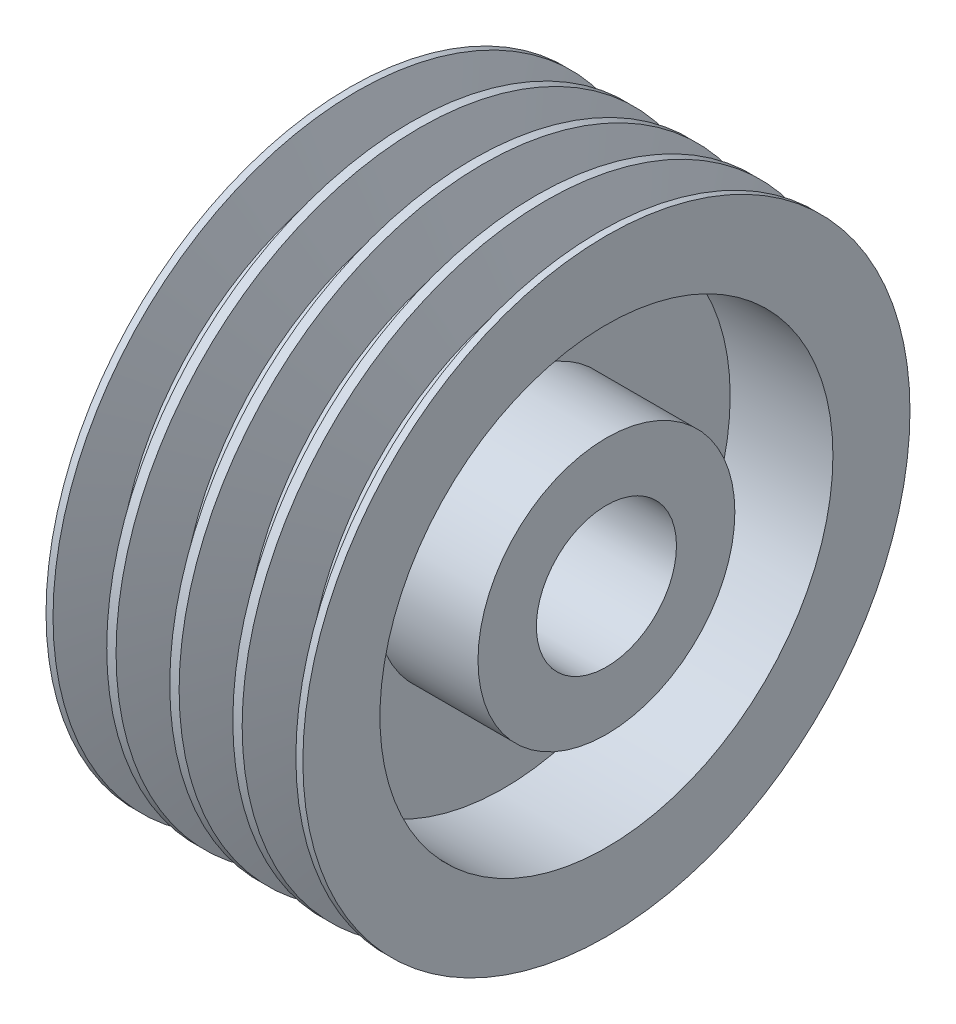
SolidWorks part; units mm, degrees
ref_plane "Front Plane" through (0, 0, 0) normal (0, 0, 1) x (1, 0, 0)
ref_plane "Top Plane" through (0, 0, 0) normal (0, 1, 0) x (1, 0, 0)
ref_plane "Right Plane" through (0, 0, 0) normal (1, 0, 0) x (0, 0, -1)
sketch "Sketch1" plane through (0, 0, 0) normal (0, 0, 1) x (1, 0, 0)
  line L0 (-55, 97) -> (-11, 97)
  line L1 (-55, 30) -> (55, 30)
  line L2 (-55, 30) -> (-55, 55)
  line L3 (-55, 130) -> (-52, 130)
  line L4 (55, 30) -> (55, 55)
  line L5 (-11, 97) -> (-11, 55)
  line L6 (-11, 55) -> (-55, 55)
  line L7 (67.6211, 0) -> (-42.3789, 0) construction
  line L8 (0, 130) -> (0, 0) construction
  line L9 (55, 97) -> (11, 97)
  line L10 (11, 97) -> (11, 55)
  line L11 (11, 55) -> (55, 55)
  line L12 (55, 97) -> (55, 130)
  line L13 (-55, 97) -> (-55, 130)
  line L14 (-52, 130) -> (-45.5, 109)
  line L15 (-45.5, 109) -> (-35.5, 109)
  line L16 (-35.5, 109) -> (-29, 130)
  line L17 (-25, 130) -> (-18.5, 109)
  line L18 (-18.5, 109) -> (-8.5, 109)
  line L19 (-8.5, 109) -> (-2, 130)
  line L20 (2, 130) -> (8.5, 109)
  line L21 (8.5, 109) -> (18.5, 109)
  line L22 (18.5, 109) -> (25, 130)
  line L23 (29, 130) -> (35.5, 109)
  line L24 (35.5, 109) -> (45.5, 109)
  line L25 (45.5, 109) -> (52, 130)
  line L26 (-29, 130) -> (-25, 130)
  line L27 (-2, 130) -> (2, 130)
  line L28 (25, 130) -> (29, 130)
  line L29 (52, 130) -> (55, 130)
  dimension "D1" = 130
  dimension "D2" = 110
  dimension "D3" = 30
  dimension "D4" = 25
  dimension "D5" = 42
  dimension "D6" = 44
  dimension "D7" = 10
  dimension "D8" = 3
  dimension "D9" = 23
  dimension "D10" = 21
  dimension "D11" = 4
revolve "Revolve1" add sketch "Sketch1" angle 360 about L7
